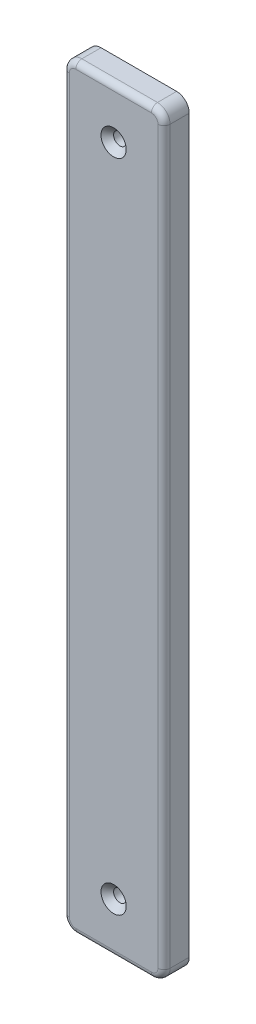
SolidWorks part; units mm, degrees
ref_plane "Front" through (0, 0, 0) normal (0, 0, 1) x (1, 0, 0)
ref_plane "Top" through (0, 0, 0) normal (0, 1, 0) x (1, 0, 0)
ref_plane "Right" through (0, 0, 0) normal (1, 0, 0) x (0, 0, -1)
sketch "Sketch1" plane through (0, 0, 0) normal (0, 0, 1) x (1, 0, 0)
  line L0 (0, 190.5) -> (0, -190.5) construction
  line L1 (25.4, -190.5) -> (-25.4, -190.5)
  line L2 (25.4, -190.5) -> (25.4, 190.5)
  line L3 (-25.4, 190.5) -> (25.4, 190.5)
  line L4 (-25.4, 190.5) -> (-25.4, -190.5)
  dimension "D1" = 381
  dimension "D3" = 50.8
extrude "Base-Extrude" add sketch "Sketch1" along normal blind 12.7
sketch "Sketch2" plane through (0, 0, 12.7) normal (0, 0, 1) x (1, 0, 0)
  line L0 (0, 0) -> (71.1, 0) construction
  line L1 (0, 190.5) -> (0, -190.5) construction
  line L2 (-25.4, 190.5) -> (25.4, 190.5) construction
  line L3 (25.4, -190.5) -> (-25.4, -190.5) construction
  circle A1 centre (0, -165.1) radius 3.175
  circle A3 centre (0, 165.1) radius 3.175
  dimension "D2" = 6.35
  dimension "D1" = 330.2
extrude "Cut-Extrude1" cut sketch "Sketch2" against normal through all
chamfer "Chamfer1" distance 3.175 angle 45 2 edges at (3.175, 165.1, 12.7) (3.175, -165.1, 12.7)
fillet "Fillet1" radius 6.35 4 edges at (25.4, -190.5, 6.35) (-25.4, -190.5, 6.35) (-25.4, 190.5, 6.35) (25.4, 190.5, 6.35)
fillet "Fillet2" radius 3.048 8 edges at (-23.5401, 188.6401, 12.7) (0, 190.5, 12.7) (23.5401, 188.6401, 12.7) (25.4, 0, 12.7) (23.5401, -188.6401, 12.7) (0, -190.5, 12.7) (-23.5401, -188.6401, 12.7) (-25.4, 0, 12.7)
